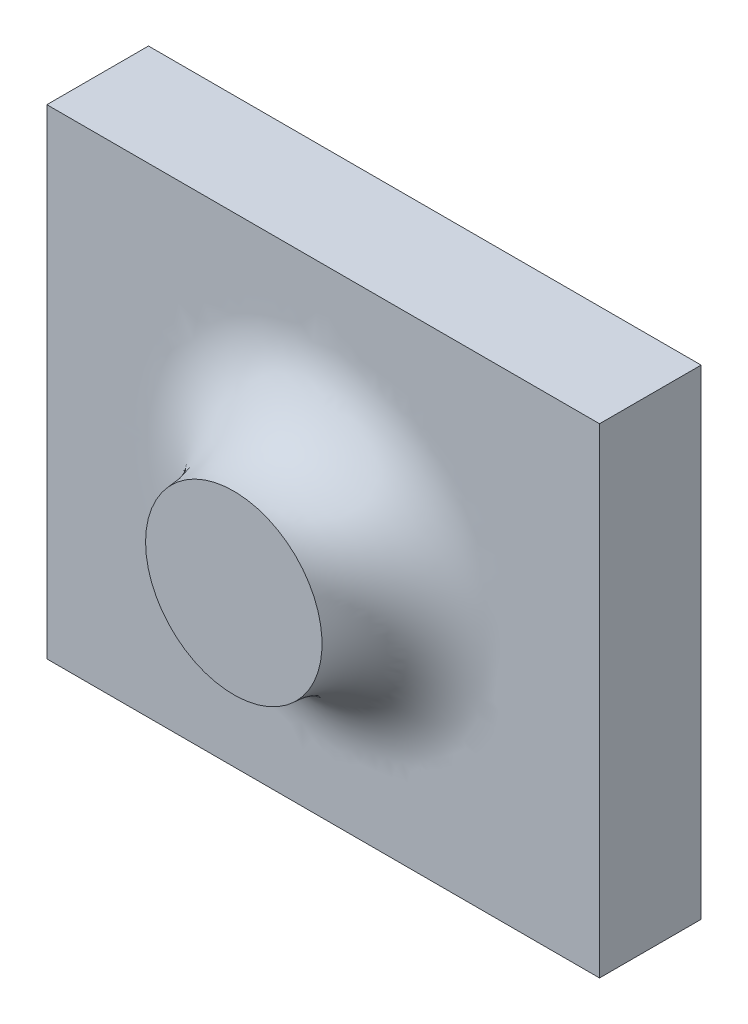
SolidWorks part; units mm, degrees
ref_plane "Ebene vorne" through (0, 0, 0) normal (0, 0, 1) x (1, 0, 0)
ref_plane "Ebene oben" through (0, 0, 0) normal (0, 1, 0) x (1, 0, 0)
ref_plane "Ebene rechts" through (0, 0, 0) normal (1, 0, 0) x (0, 0, -1)
sketch "Skizze1" plane through (0, 0, 0) normal (0, 0, 1) x (1, 0, 0)
  line L0 (-65.1047, 0) -> (0, 0) construction
  line L1 (-65.1047, -56.5464) -> (65.1047, -56.5464)
  line L2 (-65.1047, -56.5464) -> (-65.1047, 56.5464)
  line L3 (-65.1047, 56.5464) -> (65.1047, 56.5464)
  line L4 (65.1047, -56.5464) -> (65.1047, 56.5464)
  line L5 (0, 0) -> (0, 56.5464) construction
extrude "Linear austragen1" add sketch "Skizze1" against normal blind 45
sketch "Skizze2" plane through (0, 0, 0) normal (0, 1, 0) x (1, 0, 0)
  line L0 (0, 21.0635) -> (0, -102.5089) construction
  line L1 (-41.8512, 21.0635) -> (-127.9597, 21.0635) construction
  line L3 (-127.9597, 21.0635) -> (-127.9597, 0)
  line L4 (-127.9597, 0) -> (-20.7877, 0)
  arc A0 (-41.8512, 21.0635) -> (-20.7877, 0) centre (-41.8512, 0) cw construction
  spline S0 degree 3 poles (-20.7877, 0) (-20.7877, 11.8151) (-28.9128, 20.3928) (-40.7106, 21.0326) (-40.8372, 21.0395) (-41.0905, 21.0509) (-41.4709, 21.0635) (-41.7244, 21.0635) (-41.8512, 21.0635) (-41.9772, 21.0635) (-42.2292, 21.0635) (-42.6071, 21.0635) (-42.8591, 21.0635) (-42.9851, 21.0635) (-71.3099, 21.0635) (-99.6348, 21.0635) (-127.9597, 21.0635) knots 0 0 0 0 0.249273 0.249273 0.249273 0.252546 0.255819 0.259091 0.259091 0.259091 0.262343 0.265596 0.268848 0.268848 0.268848 1 1 1 1 weights 1 0.817333 0.817333 1 1 1 1 1 1 1 1 1 1 1 1 1 1
revolve "Schnitt-Rotation1" cut sketch "Skizze2" angle 360 about L0
equation "\"LÄNGE\"=0"
equation "\"BREITE\"=0"
equation "\"HÖHE\"=0"
equation "\"DURCHMESSER\"=0"
equation "\"Stückzahl\"= 1"
